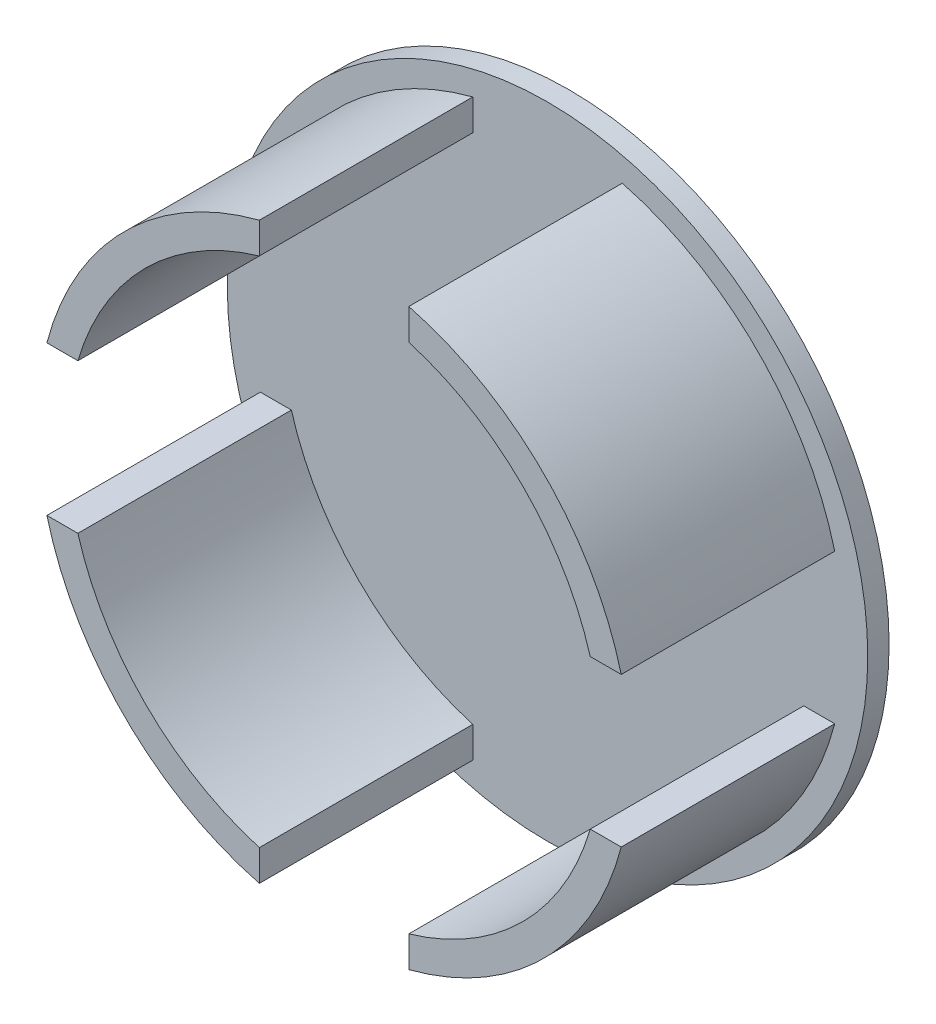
SolidWorks part; units mm, degrees
ref_plane "Ön Düzlem" through (0, 0, 0) normal (0, 0, 1) x (1, 0, 0)
ref_plane "Üst Düzlem" through (0, 0, 0) normal (0, 1, 0) x (1, 0, 0)
ref_plane "Sağ Düzlem" through (0, 0, 0) normal (1, 0, 0) x (0, 0, -1)
sketch "Çizim1" plane through (0, 0, 0) normal (0, 0, 1) x (1, 0, 0)
  circle A0 centre (0, 0) radius 15
  circle A1 centre (0, 0) radius 13.8 construction
  dimension "D1" = 30
  dimension "D2" = 27.6
extrude "Yükseklik-Ekstrüzyon1" add sketch "Çizim1" along normal blind 1
sketch "Çizim2" plane through (0, 0, 1) normal (0, 0, 1) x (1, 0, 0)
  circle A0 centre (0, 0) radius 13.9
  circle A1 centre (0, 0) radius 12.5
  dimension "D1" = 27.8
  dimension "D2" = 25
extrude "Yükseklik-Ekstrüzyon2" add sketch "Çizim2" along normal blind 10
sketch "Çizim3" plane through (0, 0, 11) normal (0, 0, 1) x (1, 0, 0)
  line L0 (-3.5, -3.5) -> (-3.5, -18.3029)
  line L1 (-3.5, 18.3029) -> (3.5, 18.3029)
  line L2 (-3.5, 18.3029) -> (-3.5, 3.5)
  line L3 (-3.5, -18.3029) -> (3.5, -18.3029)
  line L4 (3.5, 18.3029) -> (3.5, 3.5)
  line L5 (-3.5, 18.3029) -> (3.5, -18.3029) construction
  line L6 (-3.5, -18.3029) -> (3.5, 18.3029) construction
  line L7 (-20.7115, 3.5) -> (-3.5, 3.5)
  line L8 (-20.7115, 3.5) -> (-20.7115, -3.5)
  line L9 (-20.7115, -3.5) -> (-3.5, -3.5)
  line L10 (20.7115, 3.5) -> (20.7115, -3.5)
  line L11 (-20.7115, 3.5) -> (20.7115, -3.5) construction
  line L12 (-20.7115, -3.5) -> (20.7115, 3.5) construction
  line L13 (3.5, 3.5) -> (20.7115, 3.5)
  line L14 (3.5, -3.5) -> (3.5, -18.3029)
  line L15 (3.5, -3.5) -> (20.7115, -3.5)
  point P0 (0, 0)
  point P6 (0, 0)
  dimension "D1" = 7
  dimension "D2" = 7
extrude "Kes-Ekstrüzyon1" cut sketch "Çizim3" against normal blind 10
